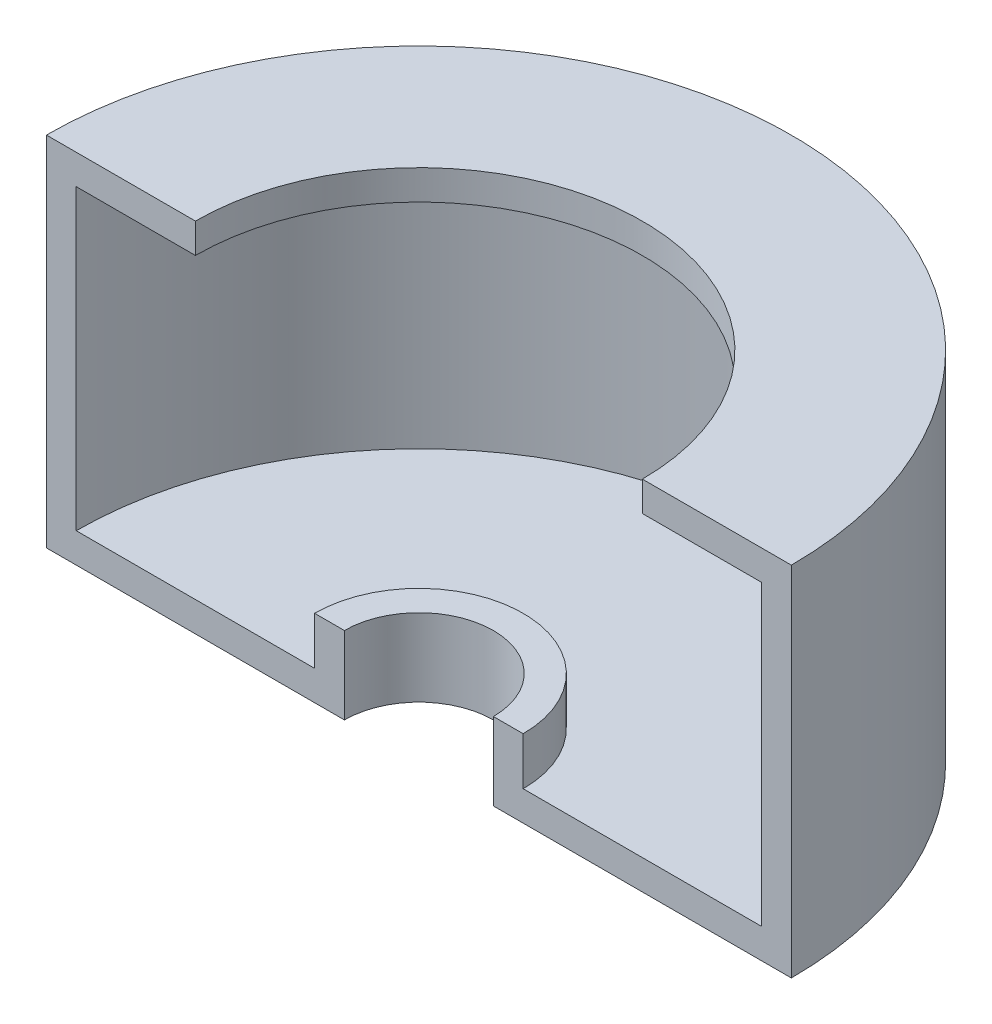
SolidWorks part; units mm, degrees
ref_plane "Plane1" through (0, 0, 0) normal (0, 0, 1) x (1, 0, 0)
ref_plane "Plane2" through (0, 0, 0) normal (0, 1, 0) x (1, 0, 0)
ref_plane "Plane3" through (0, 0, 0) normal (1, 0, 0) x (0, 0, -1)
sketch "Sketch1" plane through (0, 0, 0) normal (0, 0, 1) x (1, 0, 0)
  line L0 (0, 53.4504) -> (0, 0) construction
  line L1 (37.5, 50) -> (57.5, 50)
  line L2 (17.5, 0) -> (17.5, 8)
  line L3 (17.5, 0) -> (57.5, 0)
  line L4 (57.5, 50) -> (57.5, 0)
  point P8 (0, 0)
  point P9 (0, 61.0301)
  point P10 (0, 53.4504)
  dimension "D1" = 40
  dimension "D2" = 50
  dimension "D3" = 20
  dimension "D4" = 8
  dimension "D5" = 35
other "AlignGroup1"
other "AlignGroup2"
revolve "Revolve-Thin1" add sketch "Sketch1" angle 180 about L0
